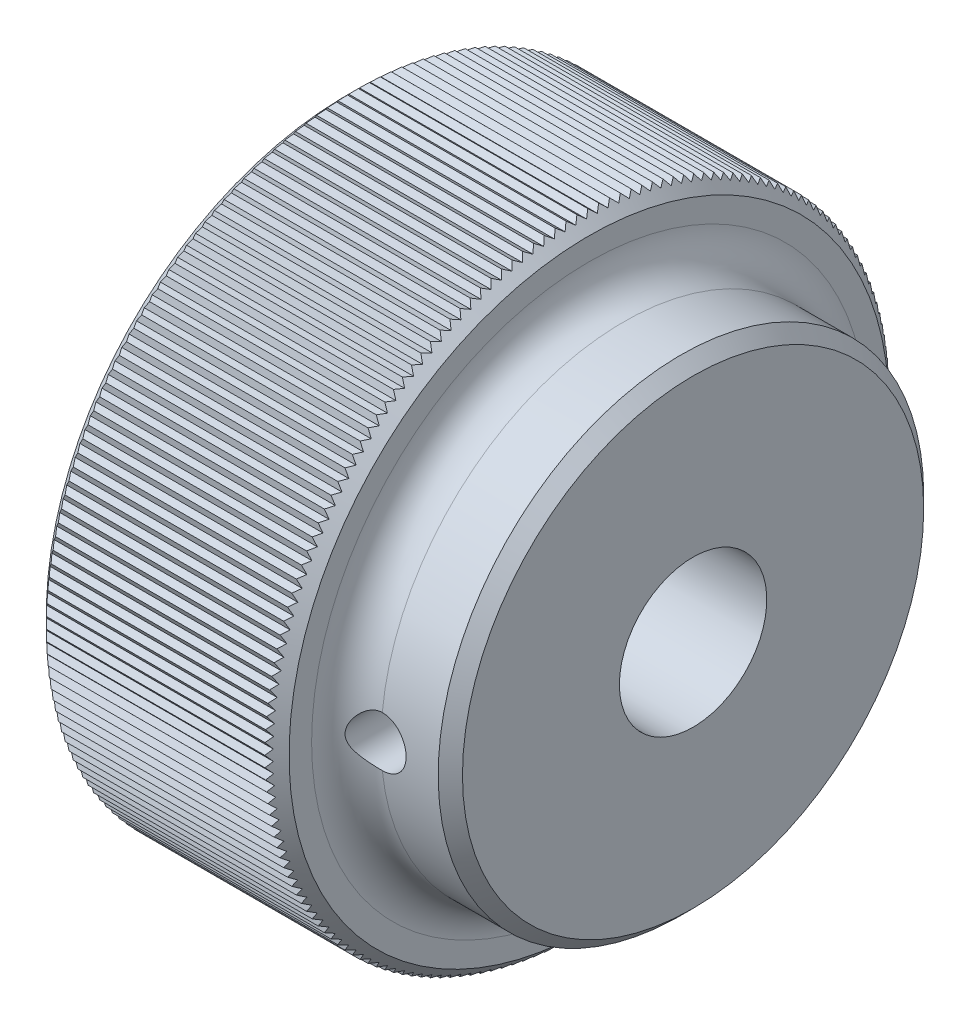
SolidWorks part; units mm, degrees
ref_plane "Front Plane" through (0, 0, 0) normal (0, 0, 1) x (1, 0, 0)
ref_plane "Top Plane" through (0, 0, 0) normal (0, 1, 0) x (1, 0, 0)
ref_plane "Right Plane" through (0, 0, 0) normal (1, 0, 0) x (0, 0, -1)
sketch "Sketch1" plane through (0, 0, 0) normal (1, 0, 0) x (0, 0, -1)
  circle A0 centre (0, 0) radius 18
  dimension "D1" = 36
extrude "Extrude1" add sketch "Sketch1" against normal blind 14
chamfer "Chamfer1" distance 0.7 angle 45 2 edges at (-14, 0, -18) (0, 0, -18)
sketch "Sketch2" plane through (0, 0, 0) normal (1, 0, 0) x (0, 0, -1)
  line L0 (0, 0) -> (0, 50000) construction
  line L1 (0, 0) -> (-872.6203, 49992.3848) construction
  line L2 (0, 18) -> (-0.3098, 17.75)
  line L3 (-0.6282, 17.989) -> (-0.3098, 17.75)
  circle A0 centre (0, 0) radius 18 construction
  arc A1 (-0.6282, 17.989) -> (0, 18) centre (-0.3211, 18.398) cw
  dimension "D1" = 1
  dimension "D2" = 0.25
extrude "Extrude2" cut sketch "Sketch2" against normal through all
pattern_circular "CirPattern1" count 180 over 360 about axis through (0, 0, 0) along (1, 0, 0) of "Extrude2"
sketch "Sketch3" plane through (0, 0, 0) normal (1, 0, 0) x (0, 0, -1)
  circle A0 centre (0, 0) radius 14
  dimension "D1" = 28
extrude "Extrude3" add sketch "Sketch3" along normal blind 6
fillet "Fillet1" radius 2 1 edges at (0, 0, -14)
sketch "Sketch4" plane through (-14, 0, 0) normal (-1, 0, 0) x (0, 0, 1)
  circle A0 centre (0, 0) radius 4.25
  dimension "D1" = 8.5
extrude "Extrude4" cut sketch "Sketch4" against normal through all
sketch "Sketch5" plane through (-14, 0, 0) normal (-1, 0, 0) x (0, 0, 1)
  circle A0 centre (0, 0) radius 15
  dimension "D1" = 30
extrude "Extrude5" cut sketch "Sketch5" against normal blind 8
chamfer "Chamfer2" distance 0.7 angle 45 3 edges at (-14, 0, 15) (6, 0, -14) (-6, 0, 4.25)
sketch "Sketch6" plane through (0, 0, 0) normal (0, 0, 1) x (1, 0, 0)
  line L0 (6, -13.3) -> (6, 13.3) construction
  circle A0 centre (2, 0) radius 1.45
  dimension "D1" = 2.9
  dimension "D2" = 4
extrude "Extrude6" cut sketch "Sketch6" along normal through all
